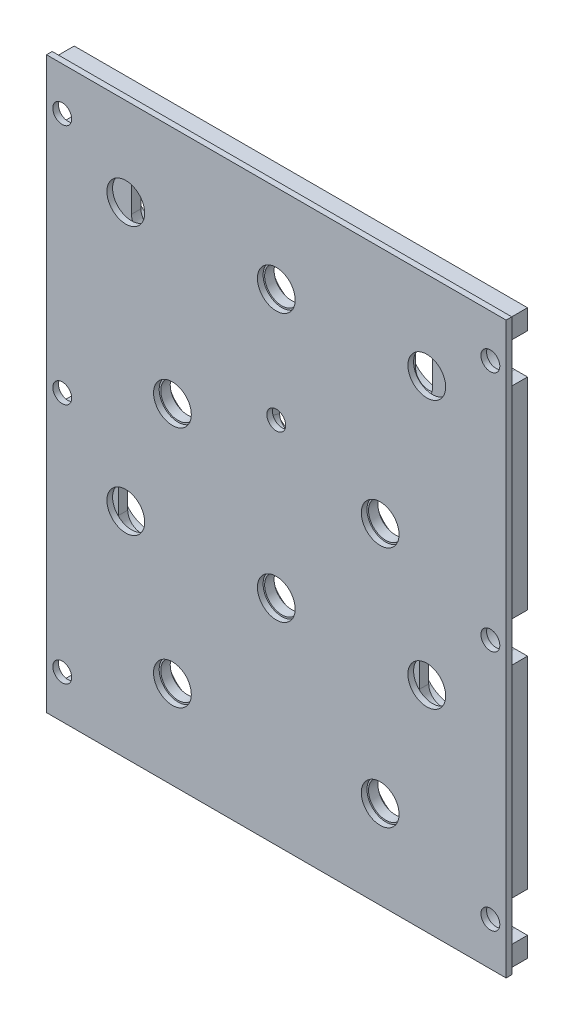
SolidWorks part; units mm, degrees
ref_plane "Front Plane" through (0, 0, 0) normal (0, 0, 1) x (1, 0, 0)
ref_plane "Top Plane" through (0, 0, 0) normal (0, 1, 0) x (1, 0, 0)
ref_plane "Right Plane" through (0, 0, 0) normal (1, 0, 0) x (0, 0, -1)
sketch "Sketch1" plane through (0, 0, 0) normal (0, 0, 1) x (1, 0, 0)
  line L0 (1, 1) -> (1, 180) construction
  line L1 (0, 0) -> (146, 0)
  line L2 (0, 0) -> (0, 181)
  line L3 (0, 181) -> (146, 181)
  line L4 (146, 0) -> (146, 181)
  line L5 (1, 180) -> (145, 180) construction
  line L6 (145, 1) -> (145, 180) construction
  line L7 (1, 1) -> (145, 1) construction
  dimension "D1" = 146
  dimension "D2" = 181
  dimension "D3" = 1
sketch "Sketch1-FrontDiffusorPlate" plane through (1, 1, -6) normal (0, 0, 1) x (1, 0, 0)
  line L0 (72, 179) -> (72, 0) construction
  line L1 (0, 0) -> (144, 0)
  line L2 (0, 0) -> (0, 6.35)
  line L3 (0, 179) -> (144, 179)
  line L4 (144, 0) -> (144, 6.35)
  line L5 (4, 179) -> (4, 0) construction
  line L6 (140, 179) -> (140, 0) construction
  line L7 (0, 166.3) -> (144, 166.3) construction
  line L8 (0, 12.7) -> (144, 12.7) construction
  line L9 (4, 19.05) -> (0, 19.05)
  line L10 (4, 6.35) -> (0, 6.35)
  line L11 (140, 6.35) -> (144, 6.35)
  line L12 (140, 19.05) -> (144, 19.05)
  line L13 (0, 89.5) -> (144, 89.5) construction
  line L14 (140, 159.95) -> (144, 159.95)
  line L15 (140, 172.65) -> (144, 172.65)
  line L16 (4, 172.65) -> (0, 172.65)
  line L17 (4, 159.95) -> (0, 159.95)
  line L18 (0, 19.05) -> (0, 83.15)
  line L19 (144, 19.05) -> (144, 83.15)
  line L20 (0, 172.65) -> (0, 179)
  line L21 (144, 172.65) -> (144, 179)
  line L22 (4, 95.85) -> (0, 95.85)
  line L23 (4, 83.15) -> (0, 83.15)
  line L24 (140, 83.15) -> (144, 83.15)
  line L25 (140, 95.85) -> (144, 95.85)
  line L26 (0, 95.85) -> (0, 159.95)
  line L27 (144, 95.85) -> (144, 159.95)
  arc A0 (4, 6.35) -> (4, 19.05) centre (4, 12.7) ccw
  arc A1 (140, 6.35) -> (140, 19.05) centre (140, 12.7) cw
  arc A2 (140, 172.65) -> (140, 159.95) centre (140, 166.3) ccw
  arc A3 (4, 172.65) -> (4, 159.95) centre (4, 166.3) cw
  arc A4 (4, 83.15) -> (4, 95.85) centre (4, 89.5) ccw
  arc A5 (140, 83.15) -> (140, 95.85) centre (140, 89.5) cw
  dimension "D6" = 12.7
  dimension "D1" = 144
  dimension "D2" = 179
  dimension "D4" = 68
  dimension "D3" = 68
  dimension "D5" = 12.7
sketch "Sketch3-FrontDiffusorPlate" plane through (1, 1, -6) normal (0, 0, 1) x (1, 0, 0)
  line L0 (0, 0) -> (144, 0) construction
  line L1 (144, 0) -> (144, 179) construction
  line L2 (144, 179) -> (0, 179) construction
  line L3 (0, 179) -> (0, 0) construction
  line L4 (72, 179) -> (72, 0) construction
  line L5 (0, 89.5) -> (144, 89.5) construction
  line L6 (39, 179) -> (39, 0) construction
  line L7 (105, 179) -> (105, 0) construction
  line L8 (0, 27) -> (144, 27) construction
  line L9 (144, 152) -> (0, 152) construction
  line L10 (0, 67) -> (144, 67) construction
  line L11 (144, 104) -> (0, 104) construction
  line L12 (144, 116) -> (0, 116) construction
  line L13 (24.191, 179) -> (24.191, 0) construction
  line L14 (119.809, 179) -> (119.809, 0) construction
  line L15 (24.191, 156.191) -> (24.191, 147.809)
  line L16 (32.573, 156.191) -> (32.573, 147.809)
  line L17 (115.618, 71.191) -> (115.618, 62.809)
  line L18 (124, 71.191) -> (124, 62.809)
  line L19 (111.427, 156.191) -> (111.427, 147.809)
  line L20 (119.809, 156.191) -> (119.809, 147.809)
  line L21 (20, 71.191) -> (20, 62.809)
  line L23 (28.382, 71.191) -> (28.382, 62.809)
  circle A0 centre (39, 27) radius 5.5
  circle A1 centre (105, 27) radius 5.5
  circle A2 centre (72, 67) radius 5.5
  circle A3 centre (39, 104) radius 5.5
  circle A4 centre (105, 104) radius 5.5
  circle A5 centre (72, 152) radius 5.5
  arc A6 (28.382, 71.191) -> (20, 71.191) centre (24.191, 71.191) ccw
  arc A7 (28.382, 62.809) -> (20, 62.809) centre (24.191, 62.809) cw
  arc A8 (32.573, 156.191) -> (24.191, 156.191) centre (28.382, 156.191) ccw
  arc A9 (32.573, 147.809) -> (24.191, 147.809) centre (28.382, 147.809) cw
  arc A10 (124, 71.191) -> (115.618, 71.191) centre (119.809, 71.191) ccw
  arc A11 (124, 62.809) -> (115.618, 62.809) centre (119.809, 62.809) cw
  arc A12 (119.809, 156.191) -> (111.427, 156.191) centre (115.618, 156.191) ccw
  arc A13 (119.809, 147.809) -> (111.427, 147.809) centre (115.618, 147.809) cw
  dimension "D3" = 11
  dimension "D4" = 11
  dimension "D6" = 11
  dimension "D7" = 11
  dimension "D8" = 11
  dimension "D9" = 11
  dimension "D1" = 27
  dimension "D2" = 27
  dimension "D5" = 40
  dimension "D10" = 36
  dimension "D11" = 12
  dimension "D12" = 24.191
  dimension "D13" = 39
sketch "Sketch4-FrontDiffusorPlate" plane through (1, 1, -6) normal (0, 0, 1) x (1, 0, 0)
  line L0 (72, 179) -> (72, 0) construction
  line L3 (144, 121) -> (74.5, 121) construction
  line L4 (144, 111) -> (74.5, 111) construction
  line L6 (144, 116) -> (0, 116) construction
  line L7 (69.5, 179) -> (69.5, 121) construction
  line L8 (74.5, 179) -> (74.5, 121) construction
  line L9 (74.5, 118.5) -> (74.5, 113.5)
  line L10 (74.5, 179) -> (74.5, 0) construction
  line L11 (69.5, 121) -> (0, 121) construction
  line L12 (144, 121) -> (0, 121) construction
  line L13 (69.5, 118.5) -> (69.5, 113.5)
  line L14 (69.5, 179) -> (69.5, 0) construction
  line L15 (69.5, 111) -> (69.5, 0) construction
  line L16 (69.5, 111) -> (0, 111) construction
  line L17 (144, 111) -> (0, 111) construction
  line L18 (74.5, 111) -> (74.5, 0) construction
  arc A0 (74.5, 118.5) -> (69.5, 118.5) centre (72, 118.5) ccw
  arc A1 (74.5, 113.5) -> (69.5, 113.5) centre (72, 113.5) cw
  dimension "D2" = 2.5
  dimension "D3" = 2.5
  dimension "D4" = 5
  dimension "D5" = 5
sketch "Sketch5-FrontDiffusorPlate" plane through (1, 1, -6) normal (0, 0, 1) x (1, 0, 0)
  line L0 (39, 27) -> (105, 27) construction
  line L1 (17, 127) -> (127, 127) construction
  line L2 (72, 179) -> (72, 0) construction
  line L5 (17, 179) -> (17, 0) construction
  line L6 (127, 179) -> (127, 0) construction
  line L7 (39, 127) -> (105, 127) construction
  circle A0 centre (72, 27) radius 2
  circle A1 centre (127, 127) radius 2
  circle A2 centre (17, 127) radius 2
  dimension "D1" = 4
  dimension "D2" = 4
  dimension "D3" = 4
sketch "Sketch6-FrontDiffusorPlate" plane through (1, 1, -6) normal (0, 0, -1) x (-1, 0, 0)
  line L0 (-28.382, 160.382) -> (-28.382, 143.618) construction
  line L1 (-115.618, 160.382) -> (-115.618, 143.618) construction
  circle A0 centre (-105, 27) radius 9.5
  circle A1 centre (-39, 27) radius 9.5
  circle A2 centre (-72, 67) radius 9.5
  circle A3 centre (-39, 104) radius 9.5
  circle A4 centre (-105, 104) radius 9.5
  circle A5 centre (-72, 152) radius 9.5
  circle A6 centre (-28.382, 152) radius 9.5
  circle A7 centre (-115.618, 152) radius 9.5
  circle A8 centre (-119.809, 67) radius 9.5
  circle A9 centre (-24.191, 67) radius 9.5
  circle A10 centre (-72, 116) radius 9.5
  dimension "D2" = 19
  dimension "D3" = 19
  dimension "D4" = 19
  dimension "D5" = 19
  dimension "D6" = 19
  dimension "D7" = 19
  dimension "D8" = 19
  dimension "D9" = 19
  dimension "D10" = 19
  dimension "D11" = 19
  dimension "D12" = 19
inserted part "FrontDiffusorPlate"
move or copy body "Body-Move/Copy2" placed by mates yes
other "<FrontDiffusorPlate>-<Back Nut Recess>"
extrude "Outline" add sketch "Sketch1" along normal blind 1.8 separate body
sketch "Sketch7" plane through (0, 0, 0) normal (0, 0, 1) x (1, 0, 0)
  line L0 (1, 68) -> (145, 68) construction
  line L1 (120.809, 180) -> (120.809, 1) construction
  line L2 (25.191, 180) -> (25.191, 1) construction
  line L3 (145, 153) -> (1, 153) construction
  line L4 (145, 117) -> (1, 117) construction
  circle A0 centre (40, 28) radius 6
  circle A1 centre (106, 28) radius 6
  circle A2 centre (120.809, 68) radius 6
  circle A3 centre (73, 68) radius 6
  circle A4 centre (25.191, 68) radius 6
  circle A5 centre (40, 105) radius 6
  circle A6 centre (106, 105) radius 6
  circle A7 centre (120.809, 153) radius 6
  circle A8 centre (73, 153) radius 6
  circle A9 centre (25.191, 153) radius 6
  circle A10 centre (73, 117) radius 3
  dimension "D1" = 12
  dimension "D2" = 12
  dimension "D3" = 12
  dimension "D4" = 12
  dimension "D5" = 12
  dimension "D6" = 12
  dimension "D7" = 12
  dimension "D8" = 12
  dimension "D9" = 12
  dimension "D10" = 12
  dimension "D11" = 6
extrude "Switch And Dial Holes" cut sketch "Sketch7" along normal blind 1.8
sketch "Sketch10" plane through (0, 0, 0) normal (0, 0, 1) x (1, 0, 0)
  circle A0 centre (5, 13.7) radius 3
  circle A1 centre (5, 90.5) radius 3
  circle A2 centre (5, 167.3) radius 3
  circle A3 centre (141, 13.7) radius 3
  circle A4 centre (141, 90.5) radius 3
  circle A5 centre (141, 167.3) radius 3
  dimension "D1" = 6
  dimension "D2" = 6
  dimension "D3" = 6
  dimension "D4" = 6
  dimension "D5" = 6
  dimension "D6" = 6
extrude "Extrude5" cut sketch "Sketch10" along normal up to next
